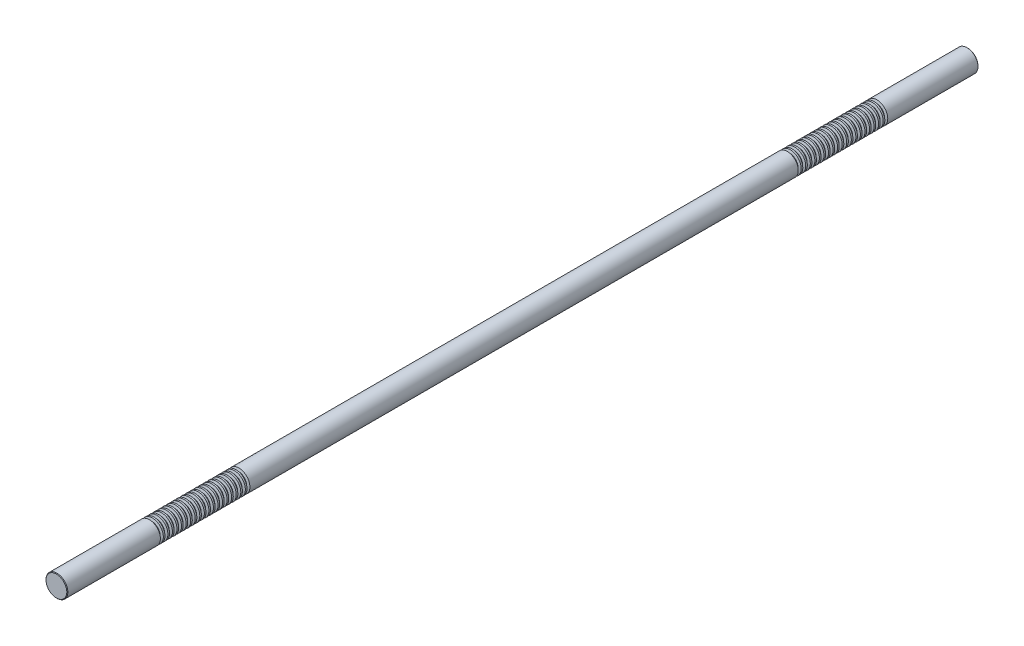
SolidWorks part; units mm, degrees
ref_plane "Front Plane" through (0, 0, 0) normal (0, 0, 1) x (1, 0, 0)
ref_plane "Top Plane" through (0, 0, 0) normal (0, 1, 0) x (1, 0, 0)
ref_plane "Right Plane" through (0, 0, 0) normal (1, 0, 0) x (0, 0, -1)
sketch "Sketch1" plane through (0, 0, 0) normal (0, 0, 1) x (1, 0, 0)
  circle A0 centre (0, 0) radius 12
  dimension "D1" = 24
extrude "Boss-Extrude1" add sketch "Sketch1" along normal mid plane 1000
chamfer "Chamfer1" distance 0.6 angle 45 2 edges at (12, 0, -500) (12, 0, 500)
sketch "Sketch2" plane through (0, 0, 0) normal (1, 0, 0) x (0, 0, -1)
  line L0 (400.3684, 12) -> (397.1316, 12)
  line L1 (499.4, 12) -> (-499.4, 12) construction
  line L2 (397.1316, 12) -> (397.8684, 9.25)
  line L3 (397.8684, 9.25) -> (399.6316, 9.25)
  line L4 (399.6316, 9.25) -> (400.3684, 12)
  line L5 (500, -11.4) -> (500, 11.4) construction
  point P4 (398.75, 12)
  point P7 (398.75, 9.25)
  point P8 (400, 10.625)
  point P9 (397.5, 10.625)
  dimension "D1" = 2.5
  dimension "D2" = 100
  dimension "D3" = 2.75
  dimension "D4" = 30
revolve "Cut-Revolve1" cut sketch "Sketch2" angle 360 about axis through (0, 0, 500) along (0, 0, -1)
pattern_linear "LPattern1" count 20 spacing 5 along (0, 0, 1) of "Cut-Revolve1"
pattern_linear "LPattern2" count 2 spacing 700 along (0, 0, 1) of "Cut-Revolve1", "LPattern1"
